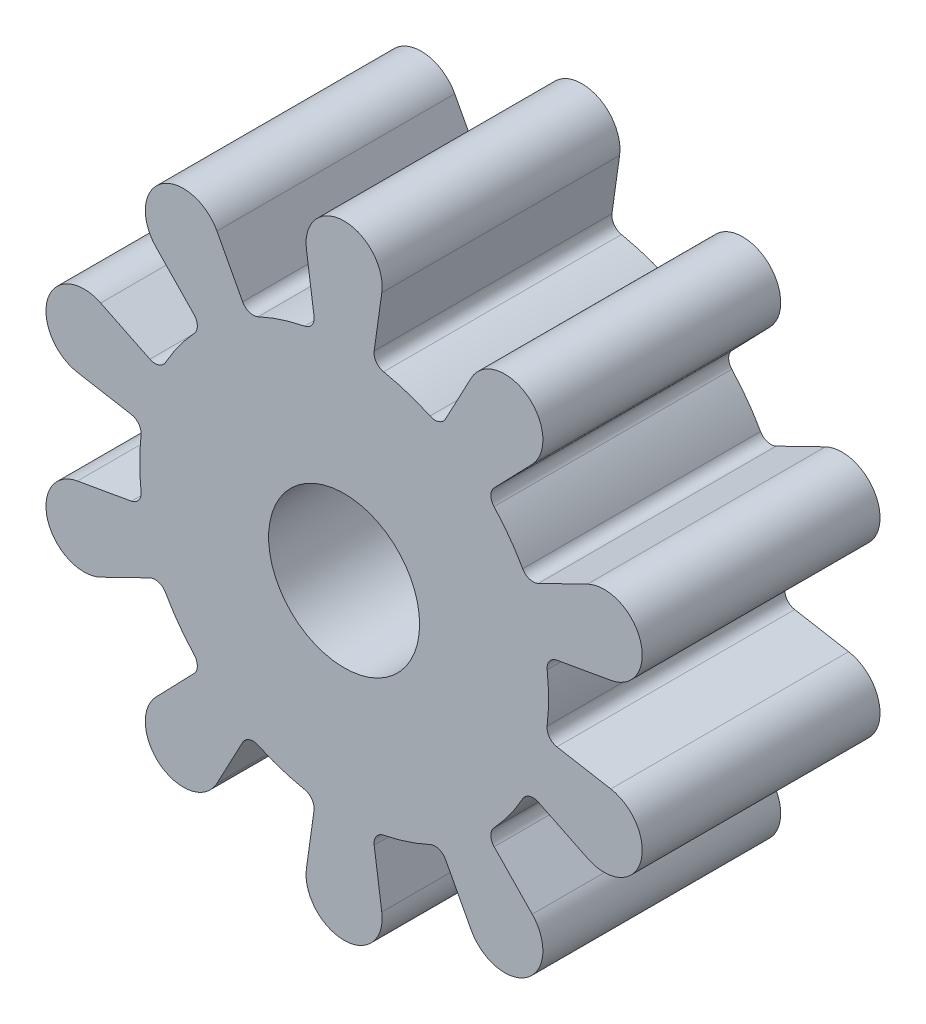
SolidWorks part; units mm, degrees
ref_plane "Спереди" through (0, 0, 0) normal (0, 0, 1) x (1, 0, 0)
ref_plane "Сверху" through (0, 0, 0) normal (0, 1, 0) x (1, 0, 0)
ref_plane "Справа" through (0, 0, 0) normal (1, 0, 0) x (0, 0, -1)
sketch "Эскиз1" plane through (0, 0, 0) normal (0, 0, 1) x (1, 0, 0)
  line L0 (0, 13.1) -> (0, 0) construction
  line L1 (0, 0) -> (13.1, 0) construction
  line L2 (-1.5844, 11.2774) -> (-1.2642, 8.9979)
  line L3 (1.5844, 11.2774) -> (1.2642, 8.9979)
  line L4 (5.3468, 10.0549) -> (4.2661, 8.0225)
  line L5 (7.9105, 8.1923) -> (6.3116, 6.5364)
  line L6 (10.2358, 4.9918) -> (8.1668, 3.9828)
  line L7 (11.2151, 1.978) -> (8.9481, 1.5782)
  line L8 (11.2151, -1.978) -> (8.9481, -1.5782)
  line L9 (10.2358, -4.9918) -> (8.1668, -3.9828)
  line L10 (7.9105, -8.1923) -> (6.3116, -6.5364)
  line L11 (5.3468, -10.0549) -> (4.2661, -8.0225)
  line L12 (1.5844, -11.2774) -> (1.2642, -8.9979)
  line L13 (-1.5844, -11.2774) -> (-1.2642, -8.9979)
  line L14 (-5.3468, -10.0549) -> (-4.2661, -8.0225)
  line L15 (-7.9105, -8.1923) -> (-6.3116, -6.5364)
  line L16 (-10.2358, -4.9918) -> (-8.1668, -3.9828)
  line L17 (-11.2151, -1.978) -> (-8.9481, -1.5782)
  line L18 (-11.2151, 1.978) -> (-8.9481, 1.5782)
  line L19 (-10.2358, 4.9918) -> (-8.1668, 3.9828)
  line L20 (-7.9105, 8.1923) -> (-6.3116, 6.5364)
  line L21 (-5.3468, 10.0549) -> (-4.2661, 8.0225)
  circle A0 centre (0, 0) radius 3.175
  circle A1 centre (0, 0) radius 13.1 construction
  circle A2 centre (0, 0) radius 11.5 construction
  arc A3 (-1.6626, 8.4377) -> (-3.6145, 7.8036) centre (0, 0) ccw
  arc A4 (1.5844, 11.2774) -> (-1.5844, 11.2774) centre (0, 11.5) ccw
  arc A5 (7.9105, 8.1923) -> (5.3468, 10.0549) centre (6.7595, 9.3037) ccw
  arc A6 (11.2151, 1.978) -> (10.2358, 4.9918) centre (10.9371, 3.5537) ccw
  arc A7 (10.2358, -4.9918) -> (11.2151, -1.978) centre (10.9371, -3.5537) ccw
  arc A8 (5.3468, -10.0549) -> (7.9105, -8.1923) centre (6.7595, -9.3037) ccw
  arc A9 (-1.5844, -11.2774) -> (1.5844, -11.2774) centre (0, -11.5) ccw
  arc A10 (-7.9105, -8.1923) -> (-5.3468, -10.0549) centre (-6.7595, -9.3037) ccw
  arc A11 (-11.2151, -1.978) -> (-10.2358, -4.9918) centre (-10.9371, -3.5537) ccw
  arc A12 (-10.2358, 4.9918) -> (-11.2151, 1.978) centre (-10.9371, 3.5537) ccw
  arc A13 (-5.3468, 10.0549) -> (-7.9105, 8.1923) centre (-6.7595, 9.3037) ccw
  arc A14 (-6.3047, 5.849) -> (-7.511, 4.1887) centre (0, 0) ccw
  arc A15 (-8.5386, 1.0261) -> (-8.5386, -1.0261) centre (0, 0) ccw
  arc A16 (-7.511, -4.1887) -> (-6.3047, -5.849) centre (0, 0) ccw
  arc A17 (-3.6145, -7.8036) -> (-1.6626, -8.4377) centre (0, 0) ccw
  arc A18 (1.6626, -8.4377) -> (3.6145, -7.8036) centre (0, 0) ccw
  arc A19 (6.3047, -5.849) -> (7.511, -4.1887) centre (0, 0) ccw
  arc A20 (8.5386, -1.0261) -> (8.5386, 1.0261) centre (0, 0) ccw
  arc A21 (7.511, 4.1887) -> (6.3047, 5.849) centre (0, 0) ccw
  arc A22 (3.6145, 7.8036) -> (1.6626, 8.4377) centre (0, 0) ccw
  arc A23 (8.1668, -3.9828) -> (7.511, -4.1887) centre (7.9477, -4.4322) ccw
  arc A24 (6.3116, -6.5364) -> (6.3047, -5.849) centre (6.6712, -6.1891) cw
  arc A25 (4.2661, -8.0225) -> (3.6145, -7.8036) centre (3.8246, -8.2573) ccw
  arc A26 (1.2642, -8.9979) -> (1.6626, -8.4377) centre (1.7593, -8.9283) cw
  arc A27 (-1.2642, -8.9979) -> (-1.6626, -8.4377) centre (-1.7593, -8.9283) ccw
  arc A28 (-4.2661, -8.0225) -> (-3.6145, -7.8036) centre (-3.8246, -8.2573) cw
  arc A29 (-6.3116, -6.5364) -> (-6.3047, -5.849) centre (-6.6712, -6.1891) ccw
  arc A30 (-8.1668, -3.9828) -> (-7.511, -4.1887) centre (-7.9477, -4.4322) cw
  arc A31 (-6.3116, 6.5364) -> (-6.3047, 5.849) centre (-6.6712, 6.1891) cw
  arc A32 (-8.1668, 3.9828) -> (-7.511, 4.1887) centre (-7.9477, 4.4322) ccw
  arc A33 (-8.9481, 1.5782) -> (-8.5386, 1.0261) centre (-9.035, 1.0858) cw
  arc A34 (-8.9481, -1.5782) -> (-8.5386, -1.0261) centre (-9.035, -1.0858) ccw
  arc A35 (8.9481, -1.5782) -> (8.5386, -1.0261) centre (9.035, -1.0858) cw
  arc A36 (8.9481, 1.5782) -> (8.5386, 1.0261) centre (9.035, 1.0858) ccw
  arc A37 (8.1668, 3.9828) -> (7.511, 4.1887) centre (7.9477, 4.4322) cw
  arc A38 (6.3116, 6.5364) -> (6.3047, 5.849) centre (6.6712, 6.1891) ccw
  arc A39 (4.2661, 8.0225) -> (3.6145, 7.8036) centre (3.8246, 8.2573) cw
  arc A40 (1.2642, 8.9979) -> (1.6626, 8.4377) centre (1.7593, 8.9283) ccw
  arc A41 (-4.2661, 8.0225) -> (-3.6145, 7.8036) centre (-3.8246, 8.2573) ccw
  arc A42 (-1.2642, 8.9979) -> (-1.6626, 8.4377) centre (-1.7593, 8.9283) cw
  point P7 (-25.1119, 4.7052)
  dimension "D1" = 6.35
  dimension "D2" = 26.2
  dimension "D3" = 23
  dimension "D4" = 17.2
  dimension "D6" = 0.5
  dimension "D5" = 10
extrude "Бобышка-Вытянуть1" add sketch "Эскиз1" along normal blind 10
